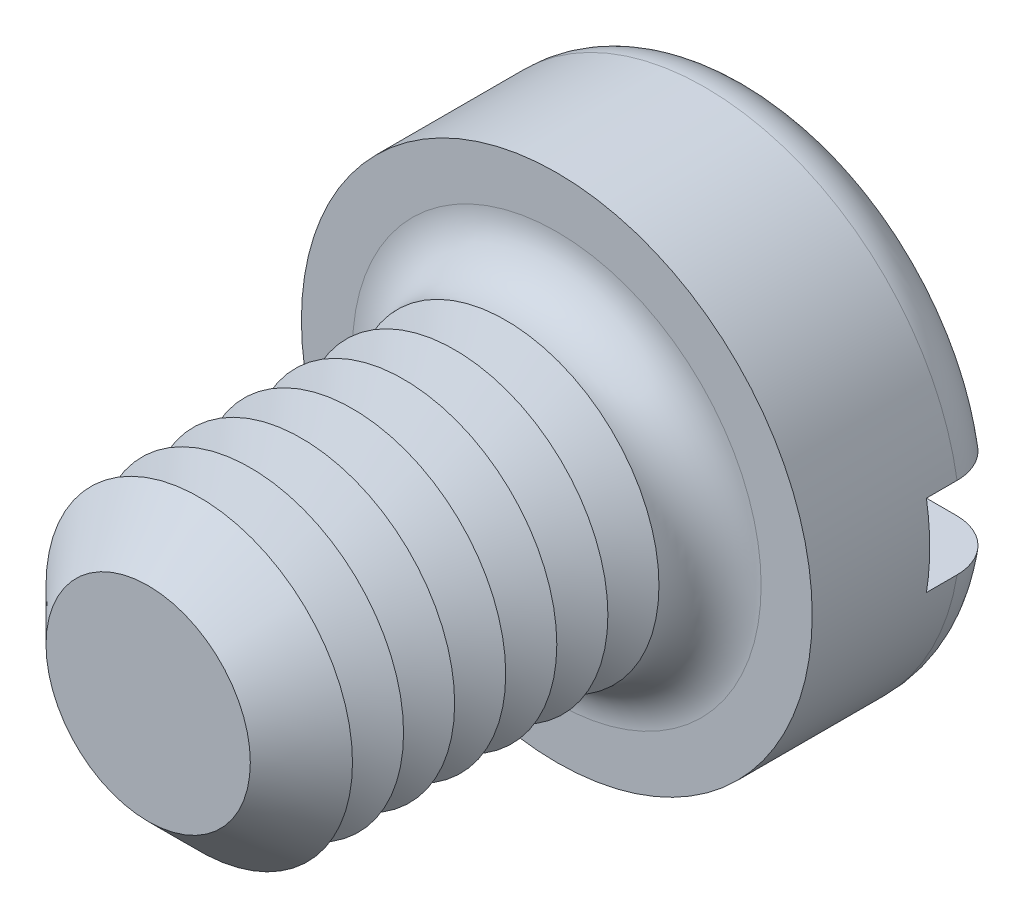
SolidWorks part; units mm, degrees
ref_plane "Front Plane" through (0, 0, 0) normal (0, 0, 1) x (1, 0, 0)
ref_plane "Top Plane" through (0, 0, 0) normal (0, 1, 0) x (1, 0, 0)
ref_plane "Right Plane" through (0, 0, 0) normal (1, 0, 0) x (0, 0, -1)
sketch "Sketch3" plane through (0, 0, 0) normal (0, 0, 1) x (1, 0, 0)
  circle A0 centre (0, 0) radius 5
  dimension "D1" = 10
extrude "Boss-Extrude2" add sketch "Sketch3" against normal blind 3.9
sketch "Sketch4" plane through (0, 0, 0) normal (0, 0, 1) x (1, 0, 0)
  circle A0 centre (0, 0) radius 3
  dimension "D1" = 6
extrude "Boss-Extrude3" add sketch "Sketch4" along normal blind 8
fillet "Fillet1" radius 1 2 edges at (5, 0, -3.9) (3, 0, 0)
chamfer "Chamfer1" distance 1 angle 45 1 edges at (3, 0, 8)
sketch "Sketch5" plane through (0, 0, 0) normal (1, 0, 0) x (0, 0, -1)
  line L0 (1.6944, 0) -> (-7.6738, 0) construction
sketch "Sketch6" plane through (0, 0, 0) normal (1, 0, 0) x (0, 0, -1)
  line L0 (-1, 3) -> (-1.5, 2.134)
  line L1 (-1.5, 2.134) -> (-2, 3)
  line L2 (-1, 3) -> (-7, 3) construction
  line L3 (-2, 3) -> (-1, 3)
  dimension "D1" = 1
revolve "Cut-Revolve1" cut sketch "Sketch6" angle 360 about L0
pattern_linear "LPattern1" count 6 spacing 1 along (0, 0, 1) of "Cut-Revolve1"
sketch "Sketch8" plane through (0, 0, -3.9) normal (0, 0, -1) x (-1, 0, 0)
  line L1 (5, -0.8) -> (-5, -0.8)
  line L2 (5, -0.8) -> (5, 0.8)
  line L3 (5, 0.8) -> (-5, 0.8)
  line L4 (-5, -0.8) -> (-5, 0.8)
  line L5 (5, -0.8) -> (-5, 0.8) construction
  line L6 (5, 0.8) -> (-5, -0.8) construction
  point P0 (0, 0)
  dimension "D1" = 10
  dimension "D2" = 1.6
extrude "Cut-Extrude1" cut sketch "Sketch8" against normal blind 1.6
